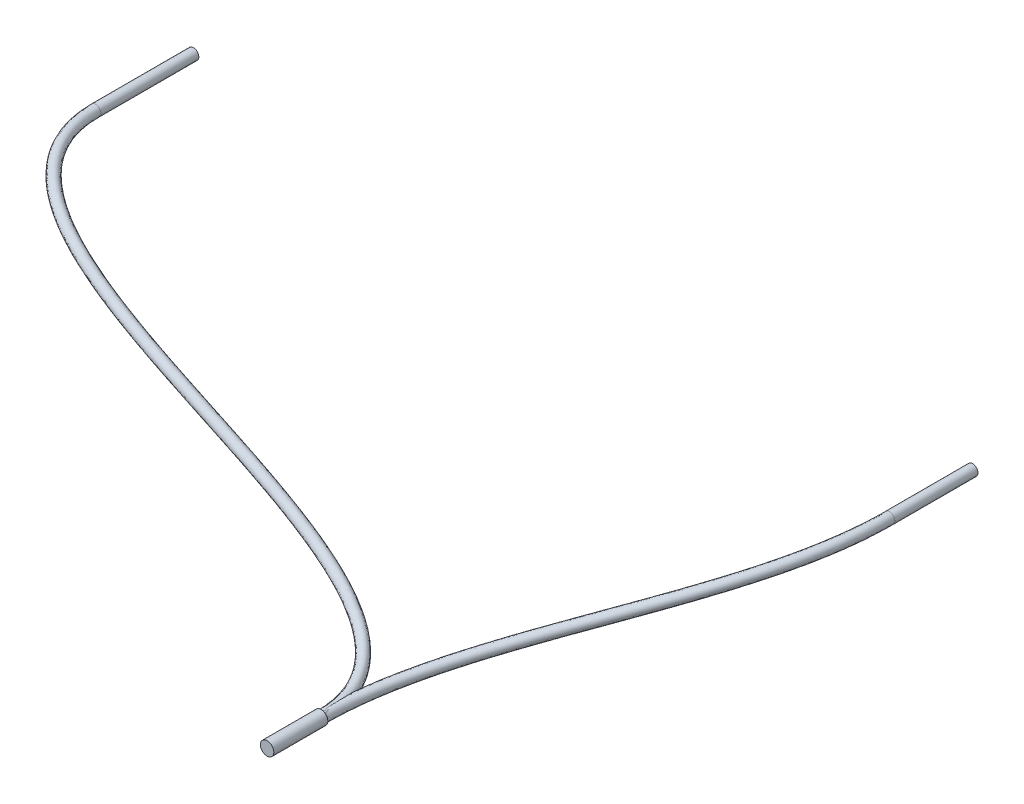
SolidWorks part; units mm, degrees
ref_plane "Front Plane" through (0, 0, 0) normal (0, 0, 1) x (1, 0, 0)
ref_plane "Top Plane" through (0, 0, 0) normal (0, 1, 0) x (1, 0, 0)
ref_plane "Right Plane" through (0, 0, 0) normal (1, 0, 0) x (0, 0, -1)
sketch3d "3DSketch1"
  line L0 (-9.7806, -7.4688, 7.9329) -> (-9.7806, -7.4688, -2.1129) construction
  line L1 (-9.7806, -7.4688, 7.9329) -> (-9.7806, -7.4688, -2.1129)
ref_plane "Plane1" through (-9.7806, -7.4688, 7.9329) normal (0, 0, -1) x (-1, 0, 0)
sketch "PipeSketch" plane through (-9.7806, -7.4688, 7.9329) normal (0, 0, -1) x (-1, 0, 0)
  circle A0 centre (0, 0) radius 1.25
  dimension "OuterDiameter" = 2.5
sweep "Cable_1" add profiles "PipeSketch" path "3DSketch1"
sketch3d "3DSketch4"
  line L0 (-100.5931, 20.4936, -69.1729) -> (-100.5931, 20.4936, -50.9537) construction
  line L1 (-100.5931, 20.4936, -69.1729) -> (-100.5931, 20.4936, -50.9537)
  spline S0 degree 3 poles (1371.5699, -432.8067, -1324.2096) (-1865.8131, 564.0305, 1227.935) (1755.4479, -551.0083, -1281.0068) (-1481.9643, 445.8379, 1271.1593) knots -1.613491 -1.613491 -1.613491 -1.613491 2.6135 2.6135 2.6135 2.6135 only from (-100.5931, 20.4936, -50.9537) to (-9.7806, -7.4688, -2.1129) construction
  spline S1 degree 3 poles (-100.5931, 20.4936, -50.9537) (-100.5931, 20.4936, -12.3362) (-9.7806, -7.4688, -40.7304) (-9.7806, -7.4688, -2.1129) knots 0 0 0 0 1 1 1 1
ref_plane "Plane4" through (-100.5931, 20.4936, -69.1729) normal (0, 0, 1) x (1, 0, 0)
sketch "Sketch4" plane through (-100.5931, 20.4936, -69.1729) normal (0, 0, 1) x (1, 0, 0)
  circle A0 centre (0, 0) radius 1
  dimension "OuterDiameter" = 2
sweep "Cable_2" add profiles "Sketch4" path "3DSketch4"
sketch3d "3DSketch5"
  line L0 (19.7008, 1.2678, -93.861) -> (19.7008, 1.2678, -78.3819) construction
  line L1 (19.7008, 1.2678, -93.861) -> (19.7008, 1.2678, -78.3819)
  spline S0 degree 3 poles (-1783.4266, -533.08, -748.9359) (1981.9671, 582.7756, 358.6756) (-1972.0608, -588.9807, -439.172) (1793.3845, 526.8901, 668.4521) knots -2.698756 -2.698756 -2.698756 -2.698756 3.698778 3.698778 3.698778 3.698778 only from (19.7008, 1.2678, -78.3819) to (-9.7806, -7.4688, -2.1129) construction
  spline S1 degree 3 poles (19.7008, 1.2678, -78.3819) (19.7008, 1.2678, -50.5332) (-9.7806, -7.4688, -29.9616) (-9.7806, -7.4688, -2.1129) knots 0 0 0 0 1 1 1 1
ref_plane "Plane5" through (19.7008, 1.2678, -93.861) normal (0, 0, 1) x (1, 0, 0)
sketch "Sketch5" plane through (19.7008, 1.2678, -93.861) normal (0, 0, 1) x (1, 0, 0)
  circle A0 centre (0, 0) radius 1
  dimension "OuterDiameter" = 2
sweep "Cable_3" add profiles "Sketch5" path "3DSketch5"
